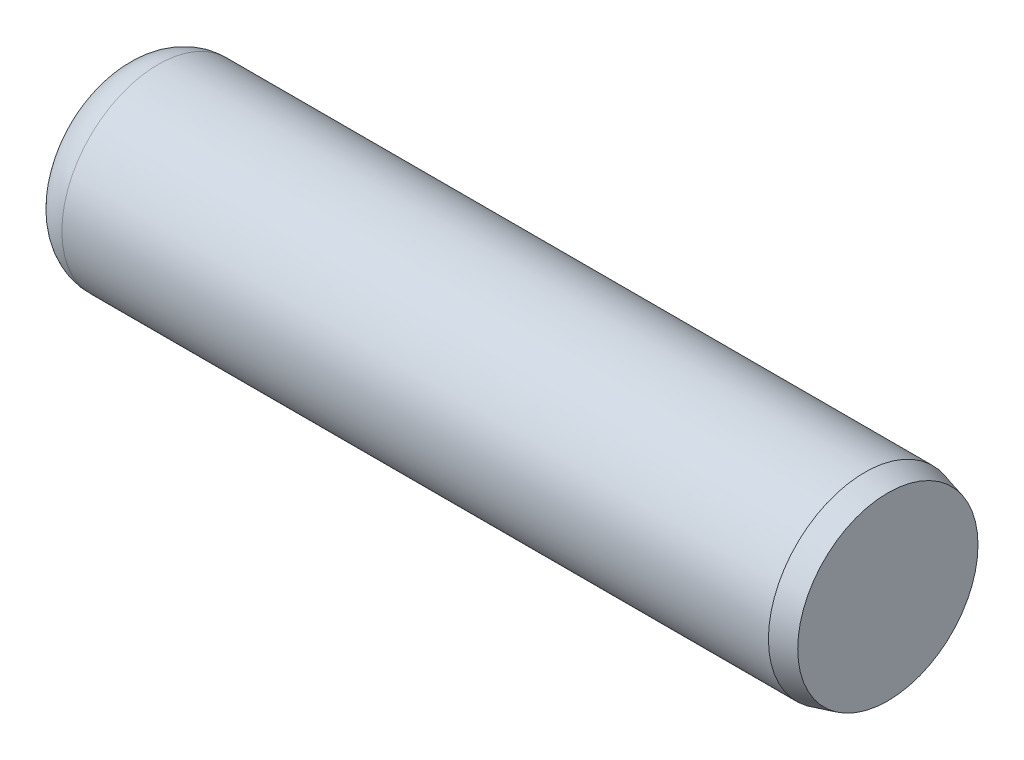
SolidWorks part; units mm, degrees
ref_plane "Plane1" through (0, 0, 0) normal (0, 0, 1) x (1, 0, 0)
ref_plane "Plane2" through (0, 0, 0) normal (0, 1, 0) x (1, 0, 0)
ref_plane "Plane3" through (0, 0, 0) normal (1, 0, 0) x (0, 0, -1)
sketch "Sketch1" plane through (0, 0, 0) normal (0, 0, 1) x (1, 0, 0)
  line L1 (-6.35, 0) -> (107.95, 0) construction
  line L2 (0, 0) -> (6.35, 0)
  line L3 (6.35, 0) -> (6.35, 0.7451)
  line L4 (6.35, 0.7451) -> (6.1589, 0.7963)
  line L5 (6.1589, 0.7963) -> (0.3185, 0.7963)
  line L6 (0, 0.4778) -> (0, 0)
  arc A0 (0.3185, 0.7963) -> (0, 0.4778) centre (0.3185, 0.4778) ccw
revolve "Base-Revolve" add sketch "Sketch1" angle 360 about L1
equation "\"D4@Sketch1\" = \"Diameter@Sketch1\" * 0.2"
equation "\"D2@Sketch1\" = \"Diameter@Sketch1\" * 0.12"
equation "\"D3@Sketch1\" = 15.0"
